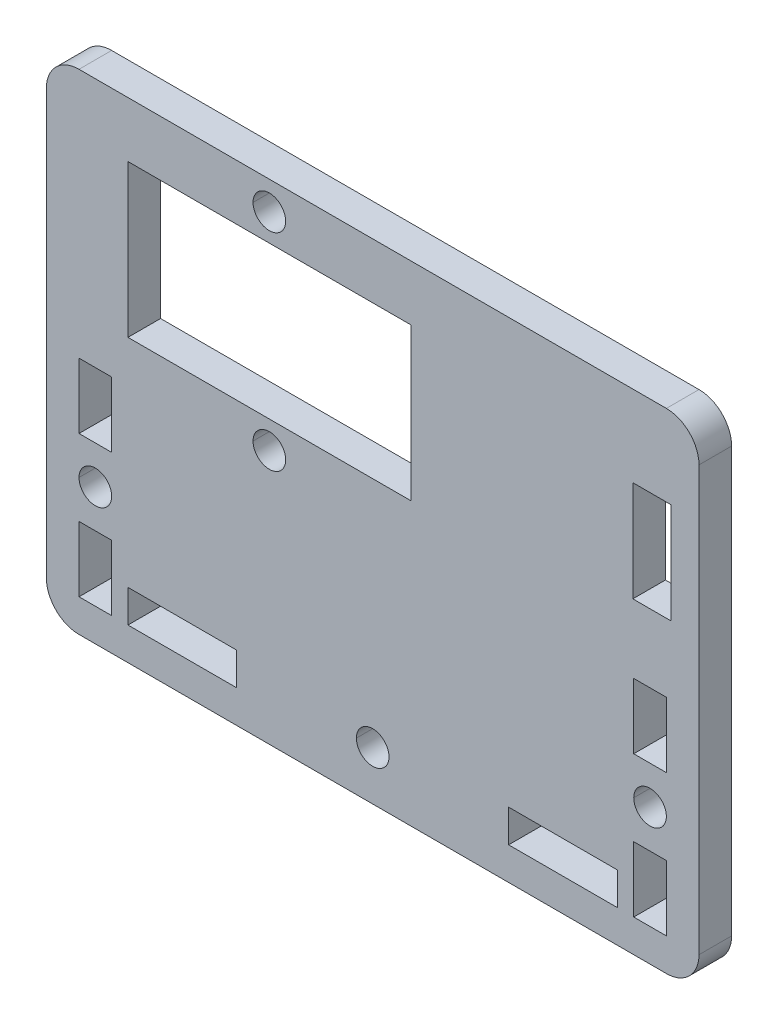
SolidWorks part; units mm, degrees
ref_plane "Front Plane" through (0, 0, 0) normal (0, 0, 1) x (1, 0, 0)
ref_plane "Top Plane" through (0, 0, 0) normal (0, 1, 0) x (1, 0, 0)
ref_plane "Right Plane" through (0, 0, 0) normal (1, 0, 0) x (0, 0, -1)
imported_body "Imported1"
sketch "Sketch2" plane through (0, 0, 0) normal (0, 0, 1) x (1, 0, 0)
  line L1 (168.58, 25.34) -> (194.58, 25.34)
  line L2 (168.58, 25.34) -> (168.58, 11.34)
  line L3 (168.58, 11.34) -> (194.58, 11.34)
  line L4 (194.58, 25.34) -> (194.58, 11.34)
  line L5 (214.998, 13.7288) -> (218.498, 13.7288)
  line L6 (214.998, 13.7288) -> (214.998, 22.9788)
  line L7 (214.998, 22.9788) -> (218.498, 22.9788)
  line L8 (218.498, 13.7288) -> (218.498, 22.9788)
extrude "Cut-Extrude1" cut sketch "Sketch2" along normal blind 3
